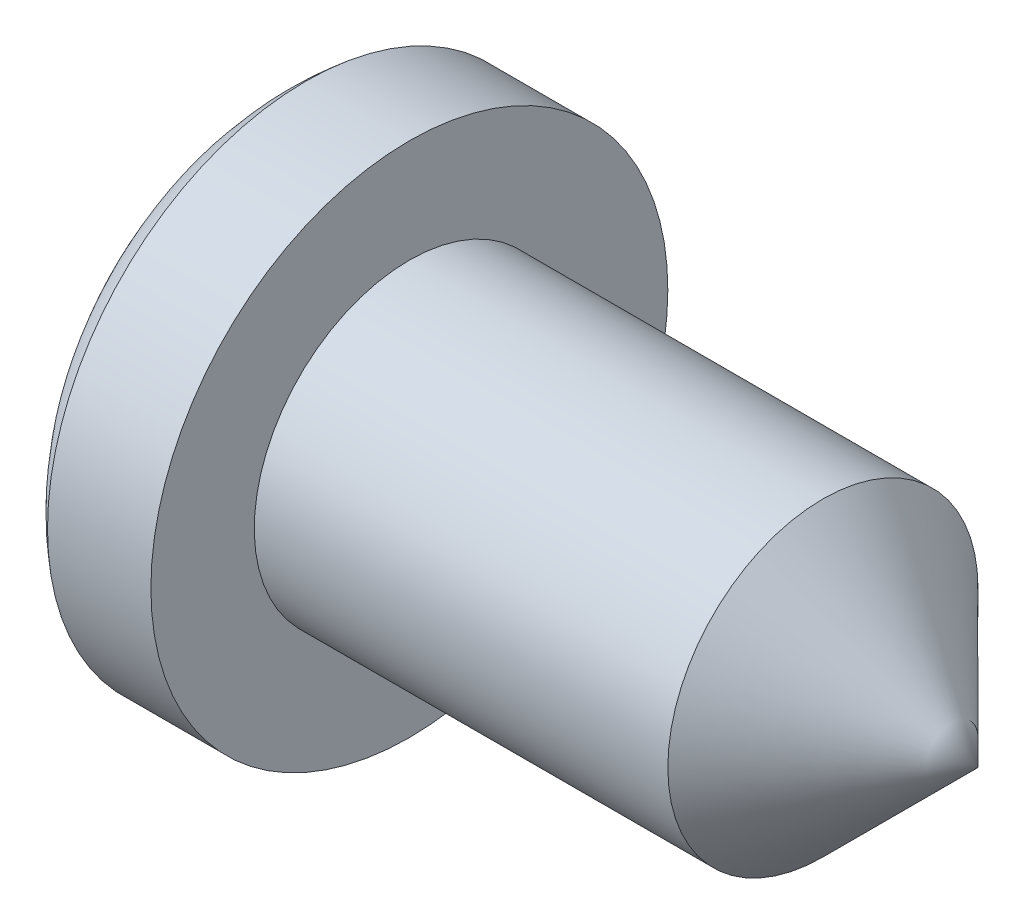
SolidWorks part; units mm, degrees
ref_plane "Plan de face" through (0, 0, 0) normal (0, 0, 1) x (1, 0, 0)
ref_plane "Plan de dessus" through (0, 0, 0) normal (0, 1, 0) x (1, 0, 0)
ref_plane "Plan de droite" through (0, 0, 0) normal (1, 0, 0) x (0, 0, -1)
sketch "Esquisse1" plane through (0, 0, 0) normal (0, 0, 1) x (1, 0, 0)
  line L1 (15.9436, 28.466) -> (16.9436, 28.466)
  line L2 (16.9436, 28.466) -> (16.9436, 27.466)
  line L3 (16.9436, 28.466) -> (16.9436, 27.466)
  line L4 (16.9436, 27.466) -> (20.9436, 27.466)
  line L5 (20.9436, 27.466) -> (22.4436, 25.966)
  line L6 (22.4436, 25.966) -> (15.4436, 25.966)
  arc A0 (15.4436, 25.966) -> (15.9436, 28.466) centre (17.2048, 26.9138) cw
  dimension "D4" = 2
  dimension "D1" = 4
  dimension "D2" = 1.5
  dimension "D3" = 1
  dimension "D5" = 1
  dimension "D6" = 7
  dimension "D7" = 1.5
revolve "Révolution8" add sketch "Esquisse1" angle 360 about L6
sketch "Esquisse6" plane through (0, 0, 0) normal (0, 0, 1) x (1, 0, 0)
  line L0 (14.3246, 28.0332) -> (16.2436, 26.1142)
  line L1 (22.4436, 25.966) -> (15.4436, 25.966) construction
  line L2 (16.2436, 25.8179) -> (16.2436, 26.1142)
  line L3 (14.3246, 23.8989) -> (14.3246, 28.0332)
  line L4 (16.2436, 25.8179) -> (14.3246, 23.8989)
  line L5 (16.9436, 23.466) -> (16.9436, 28.466) construction
  dimension "D1" = 45
  dimension "D2" = 45
  dimension "D3" = 0.7
  dimension "D4" = 0.2963
  dimension "D5" = 0.1481
extrude "Enlèv. mat.-Extru.3" cut sketch "Esquisse6" against normal mid plane 0.4
pattern_circular "Répétition circulaire1" count 2 every 90 about axis through (0, 25.966, 0) along (1, 0, 0) of "Enlèv. mat.-Extru.3"
